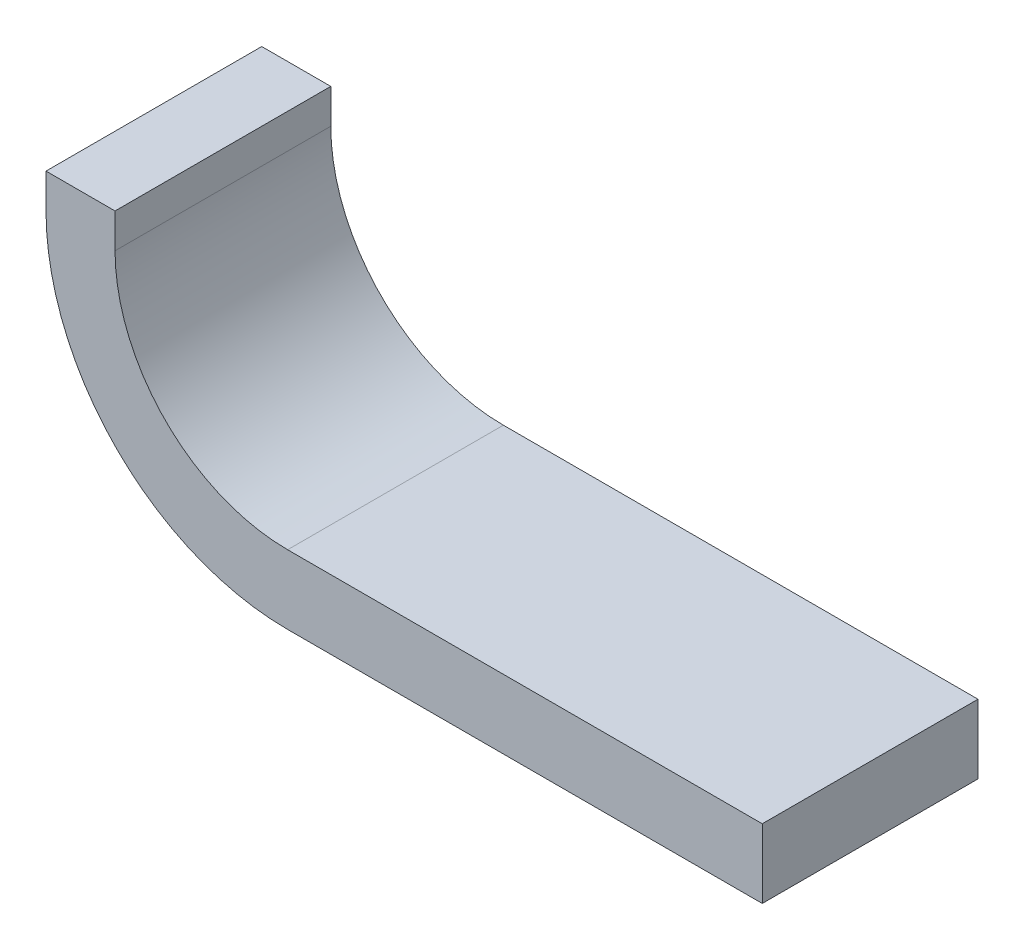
SolidWorks part; units mm, degrees
ref_plane "Face" through (0, 0, 0) normal (0, 0, 1) x (1, 0, 0)
ref_plane "Dessus" through (0, 0, 0) normal (0, 1, 0) x (1, 0, 0)
ref_plane "Droite" through (0, 0, 0) normal (1, 0, 0) x (0, 0, -1)
sketch "Esquisse1" plane through (0, 0, 0) normal (0, 0, 1) x (1, 0, 0)
  line L0 (0, 0) -> (-55, 0)
  line L1 (-83, 28) -> (-83, 32)
  line L2 (-83, 32) -> (-75, 32)
  line L3 (-75, 32) -> (-75, 28)
  line L4 (-55, 8) -> (0, 8)
  line L5 (0, 8) -> (0, 0)
  arc A0 (-55, 0) -> (-83, 28) centre (-55, 28) cw
  arc A1 (-75, 28) -> (-55, 8) centre (-55, 28) ccw
  dimension "D4" = 28
  dimension "D1" = 55
  dimension "D2" = 55
  dimension "D3" = 8
  dimension "D5" = 4
  dimension "D6" = 8
extrude "Extrusion1" add sketch "Esquisse1" along normal blind 25
